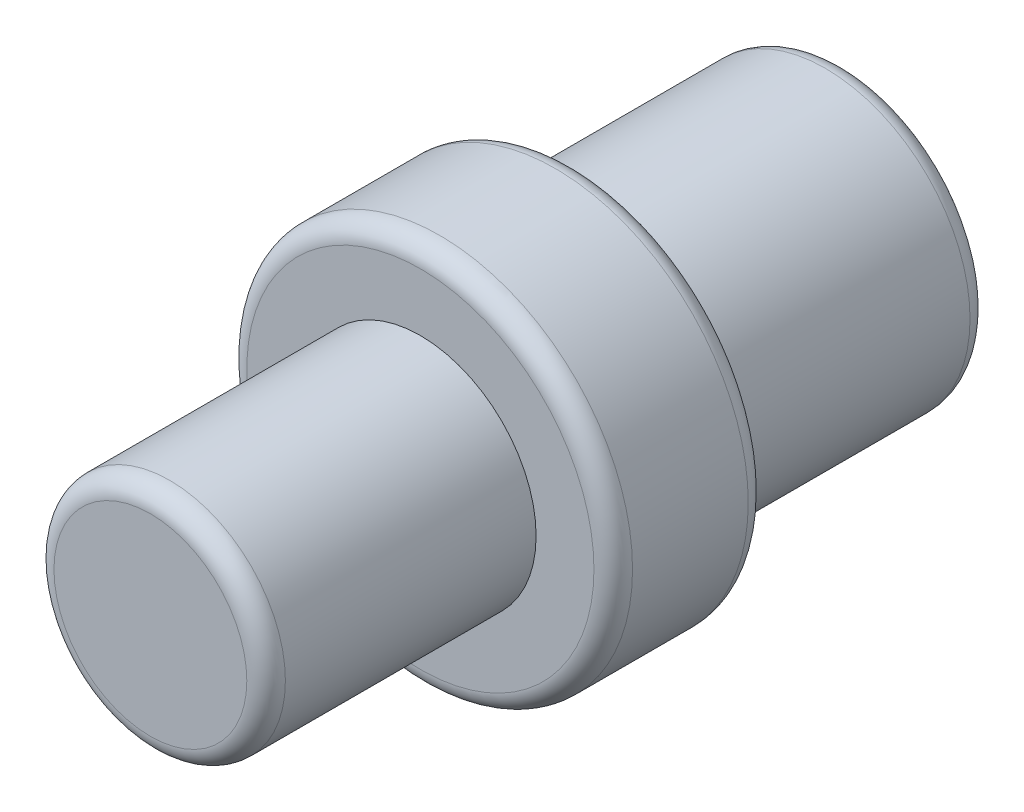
SolidWorks part; units mm, degrees
ref_plane "Face" through (0, 0, 0) normal (0, 0, 1) x (1, 0, 0)
ref_plane "Dessus" through (0, 0, 0) normal (0, 1, 0) x (1, 0, 0)
ref_plane "Droite" through (0, 0, 0) normal (1, 0, 0) x (0, 0, -1)
sketch "Esquisse1" plane through (0, 0, 0) normal (0, 0, 1) x (1, 0, 0)
  circle A0 centre (0, 0) radius 5
  dimension "D1" = 10
extrude "Extrusion1" add sketch "Esquisse1" along normal blind 4
sketch "Esquisse2" plane through (0, 0, 4) normal (0, 0, 1) x (1, 0, 0)
  circle A0 centre (0, 0) radius 3
  dimension "D1" = 6
extrude "Extrusion2" add sketch "Esquisse2" along normal blind 7
sketch "Esquisse3" plane through (0, 0, 0) normal (0, 0, -1) x (-1, 0, 0)
  circle A0 centre (0, 0) radius 3.75
  dimension "D1" = 7.5
extrude "Extrusion3" add sketch "Esquisse3" along normal blind 7
fillet "Congé1" radius 0.5
